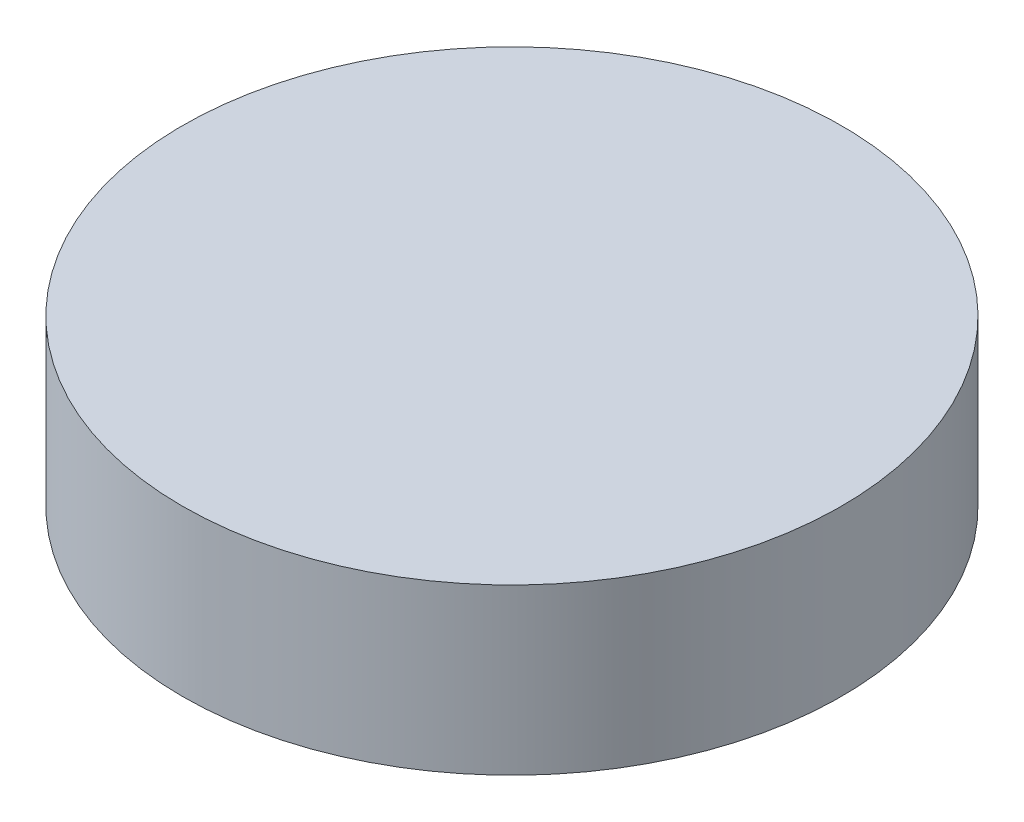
SolidWorks part; units mm, degrees
ref_plane "前视基准面" through (0, 0, 0) normal (0, 0, 1) x (1, 0, 0)
ref_plane "上视基准面" through (0, 0, 0) normal (0, 1, 0) x (1, 0, 0)
ref_plane "右视基准面" through (0, 0, 0) normal (1, 0, 0) x (0, 0, -1)
other "Configuration Table"
sketch "草图1" plane through (0, 0, 0) normal (0, 1, 0) x (1, 0, 0)
  circle A0 centre (0, 0) radius 4
  dimension "D1" = 8
extrude "凸台-拉伸1" add sketch "草图1" along normal blind 2
